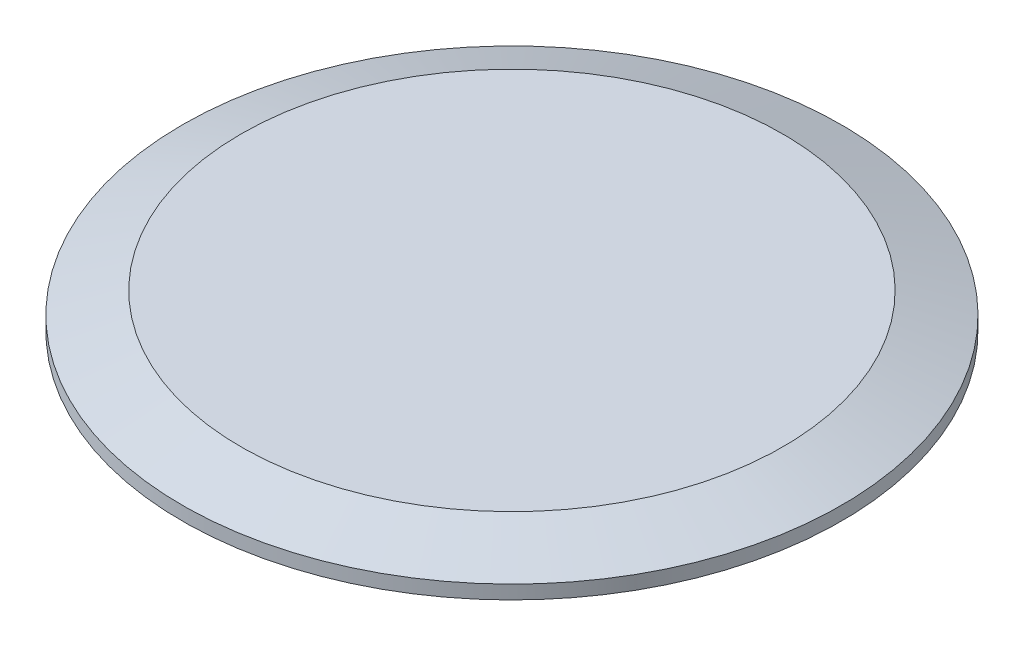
SolidWorks part; units mm, degrees
ref_plane "Front Plane" through (0, 0, 0) normal (0, 0, 1) x (1, 0, 0)
ref_plane "Top Plane" through (0, 0, 0) normal (0, 1, 0) x (1, 0, 0)
ref_plane "Right Plane" through (0, 0, 0) normal (1, 0, 0) x (0, 0, -1)
sketch "Sketch1" plane through (0, 0, 0) normal (0, 0, 1) x (1, 0, 0)
  line L0 (0, 0) -> (-127.1632, 0)
  line L1 (-134.239, 0) -> (-134.239, 5.588)
  line L2 (-134.239, 5.588) -> (-110.3722, 14.2748)
  line L3 (-110.3722, 14.2748) -> (0, 14.2748)
  line L4 (0, 14.2748) -> (0, 0) construction
  line L5 (-130.7992, 0) -> (-134.239, 0)
  line L6 (0, 0) -> (0, 14.2748)
  arc A0 (-127.8857, 0.4745) -> (-130.0767, 0.4745) centre (-128.9812, 0) ccw
  arc A1 (-127.1632, 0) -> (-127.8857, 0.4745) centre (-127.1632, 0.7874) cw
  arc A2 (-130.7992, 0) -> (-130.0767, 0.4745) centre (-130.7992, 0.7874) ccw
  point P13 (-130.175, 0)
  dimension "D1" = 2.3876
  dimension "D2" = 0.7874
  dimension "D3" = 134.239
  dimension "D4" = 128.9812
  dimension "D5" = 5.588
  dimension "D6" = 20
  dimension "D7" = 14.2748
revolve "Revolve1" add sketch "Sketch1" angle 360 about L4
